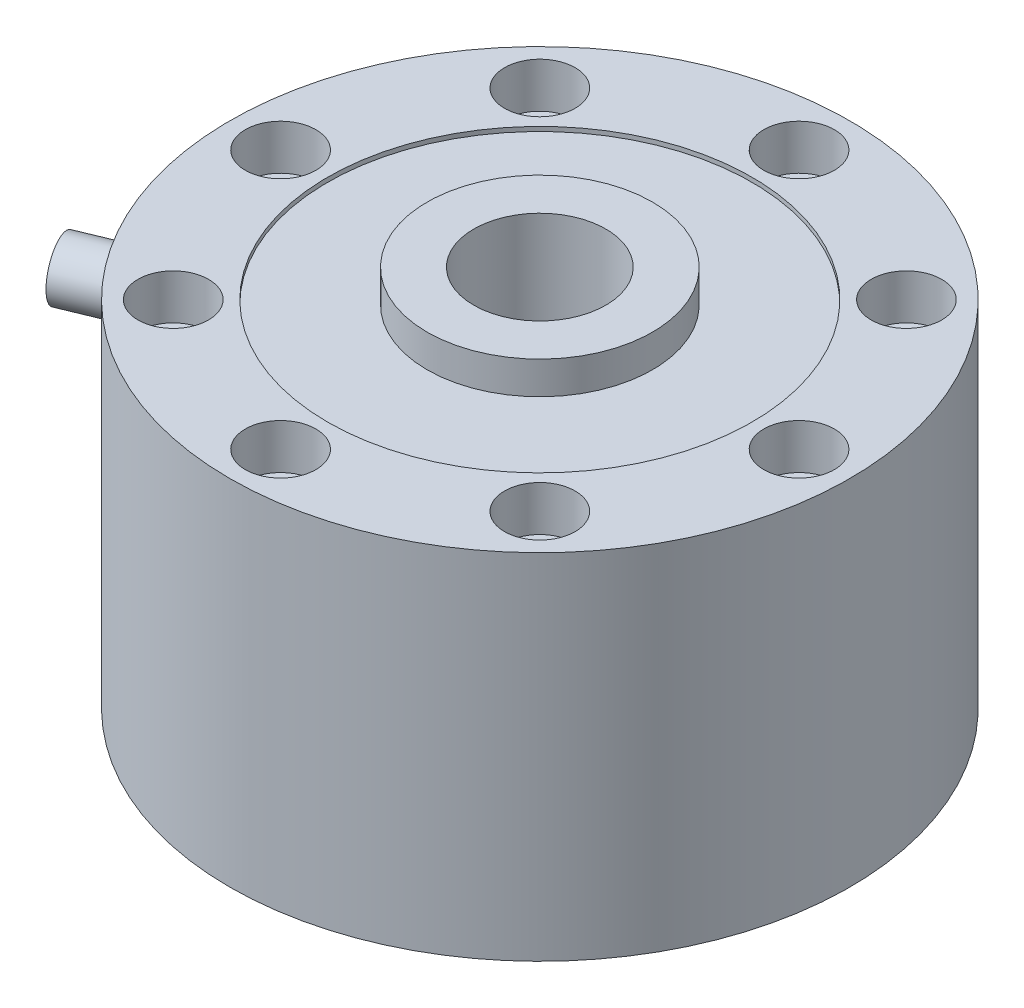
SolidWorks part; units mm, degrees
ref_plane "Front Plane" through (0, 0, 0) normal (0, 0, 1) x (1, 0, 0)
ref_plane "Top Plane" through (0, 0, 0) normal (0, 1, 0) x (1, 0, 0)
ref_plane "Right Plane" through (0, 0, 0) normal (1, 0, 0) x (0, 0, -1)
sketch "Sketch1" plane through (0, 0, 0) normal (0, 1, 0) x (1, 0, 0)
  circle A0 centre (0, 0) radius 69.85
  dimension "D1" = 139.7
extrude "Boss-Extrude1" add sketch "Sketch1" along normal blind 79.756 contours A0
sketch "Sketch2" plane through (0, 79.756, 0) normal (0, 1, 0) x (1, 0, 0)
  circle A0 centre (0, 0) radius 25.4
  dimension "D1" = 50.8
extrude "Boss-Extrude2" add sketch "Sketch2" along normal blind 6.35 contours A0
sketch "Sketch3" plane through (0, 0, 0) normal (0, -1, 0) x (1, 0, 0)
  circle A0 centre (0, 0) radius 25.4
  dimension "D1" = 50.8
extrude "Boss-Extrude3" add sketch "Sketch3" along normal blind 1.27 contours A0
hole_wizard "1-1/4-12 Tapped Hole1" positions "Sketch5" profile "Sketch4" tap size "1-1/4-12" standard "ANSI Inch"
sketch "Sketch5" plane through (0, 86.106, 0) normal (0, 1, 0) x (1, 0, 0)
  point P0 (0, 0)
sketch "Sketch4" plane through (0, 86.106, 0) normal (1, 0, 0) x (0, 0, 1)
  line L0 (0, 0) -> (0, 47.0427)
  line L1 (0, 47.0427) -> (14.8831, 38.1)
  line L2 (14.8831, 38.1) -> (14.8831, 0)
  line L5 (14.8831, 0) -> (0, 0)
  line L10 (0, 47.0427) -> (-14.8831, 38.1) construction
  line L11 (0, -6.35) -> (0, 107.95) construction
  dimension "Tap Drill Dia." = 29.7663
  dimension "Tap Drill Depth" = 38.1
  dimension "Drill Angle" = 118
hole_wizard "1-1/4-12 Tapped Hole4" positions "Sketch13" profile "Sketch12" tap size "1-1/4-12" standard "ANSI Inch"
sketch "Sketch13" plane through (0, -1.27, 0) normal (0, -1, 0) x (-1, 0, 0)
  point P0 (0, 0)
sketch "Sketch12" plane through (0, -1.27, 0) normal (1, 0, 0) x (0, 0, -1)
  line L0 (0, 0) -> (0, 39.4227)
  line L1 (0, 39.4227) -> (14.8831, 30.48)
  line L2 (14.8831, 30.48) -> (14.8831, 0)
  line L5 (14.8831, 0) -> (0, 0)
  line L10 (0, 39.4227) -> (-14.8831, 30.48) construction
  line L11 (0, -6.35) -> (0, 107.95) construction
  dimension "Tap Drill Dia." = 29.7663
  dimension "Tap Drill Depth" = 30.48
  dimension "Drill Angle" = 118
sketch "Sketch18" plane through (0, 79.756, 0) normal (0, 1, 0) x (1, 0, 0)
  line L0 (0, 0) -> (0, 87.1456) construction
  circle A0 centre (0, 0) radius 58.42 construction
  circle A1 centre (0, 58.42) radius 5.1562
  dimension "D1" = 116.84
  dimension "D2" = 10.3124
extrude "Cut-Extrude2" cut sketch "Sketch18" against normal through all
sketch "Sketch19" plane through (0, 79.756, 0) normal (0, 1, 0) x (1, 0, 0)
  circle A0 centre (0, 58.42) radius 7.9502
  dimension "D1" = 15.9004
extrude "Cut-Extrude3" cut sketch "Sketch19" against normal blind 10.16
pattern_circular "CirPattern1" count 8 over 360 about axis through (0, 0, 0) along (0, 1, 0) of "Cut-Extrude2", "Cut-Extrude3"
sketch "Sketch20" plane through (0, 79.756, 0) normal (0, 1, 0) x (1, 0, 0)
  circle A0 centre (0, 0) radius 25.4
  circle A1 centre (0, 0) radius 47.8187
extrude "Cut-Extrude4" cut sketch "Sketch20" against normal blind 1
sketch "Sketch21" plane through (0, 79.756, 0) normal (0, 1, 0) x (1, 0, 0)
  line L0 (0, 0) -> (-97.5167, 0) construction
  line L1 (0, 0) -> (-104.1507, -43.1406) construction
  line L2 (-83.1113, 18.1215) -> (-49.7328, -62.4611) construction
  dimension "D1" = 22.5
  dimension "D2" = 90
  dimension "D3" = 69.85
ref_plane "Plane1" through (-64.533, 0, 26.7304) normal (-0.9239, 0, 0.3827) x (0.3827, 0, 0.9239)
sketch "Sketch22" plane through (-64.533, 0, 26.7304) normal (-0.9239, 0, 0.3827) x (0.3827, 0, 0.9239)
  circle A0 centre (0, 63.5511) radius 6.35
  dimension "D1" = 12.7
extrude "Boss-Extrude4" add sketch "Sketch22" along normal blind 12.7 and the other way up to surface (12.7 mm away)
